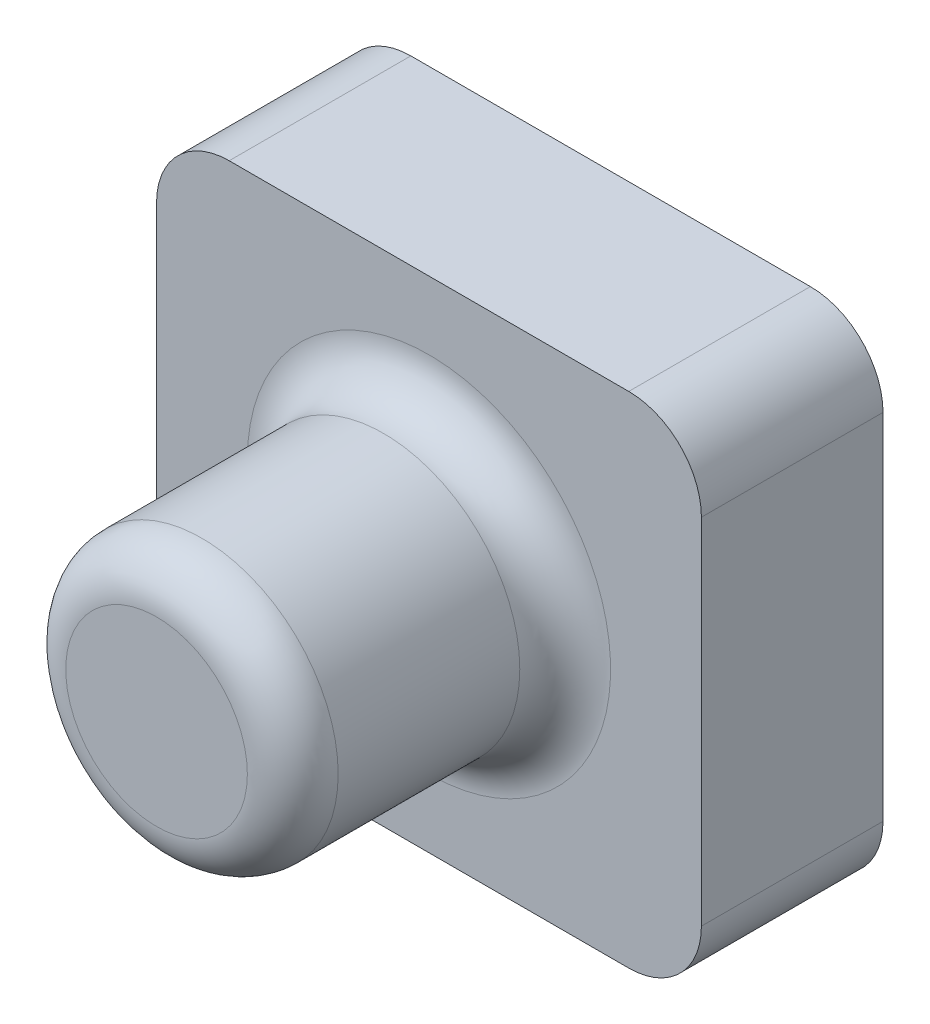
SolidWorks part; units mm, degrees
ref_plane "Front Plane" through (0, 0, 0) normal (0, 0, 1) x (1, 0, 0)
ref_plane "Top Plane" through (0, 0, 0) normal (0, 1, 0) x (1, 0, 0)
ref_plane "Right Plane" through (0, 0, 0) normal (1, 0, 0) x (0, 0, -1)
sketch "Sketch1" plane through (0, 0, 0) normal (0, 0, 1) x (1, 0, 0)
  line L1 (0, 0) -> (60, 0)
  line L2 (0, 0) -> (0, 55)
  line L3 (0, 55) -> (60, 55)
  line L4 (60, 0) -> (60, 55)
  dimension "height" = 55
  dimension "width" = 60
extrude "Main Body" add sketch "Sketch1" along normal blind 20
fillet "Main Body Fillet" radius 8 4 edges at (0, 0, 10) (60, 0, 10) (60, 55, 10) (0, 55, 10)
sketch "Sketch2" plane through (0, 0, 20) normal (0, 0, 1) x (1, 0, 0)
  line L0 (30, 55) -> (30, 27.5) construction
  line L1 (52, 55) -> (8, 55) construction
  line L2 (30, 27.5) -> (0, 27.5) construction
  line L3 (0, 47) -> (0, 8) construction
  circle A0 centre (30, 27.5) radius 15
  dimension "D1" = 30
extrude "Round Boss" add sketch "Sketch2" along normal blind 30
fillet "Round Boss Fillet" radius 5 2 edges at (45, 27.5, 50) (15, 27.5, 20)
shell "Shell1" thickness 3
other "PropertyManager"
